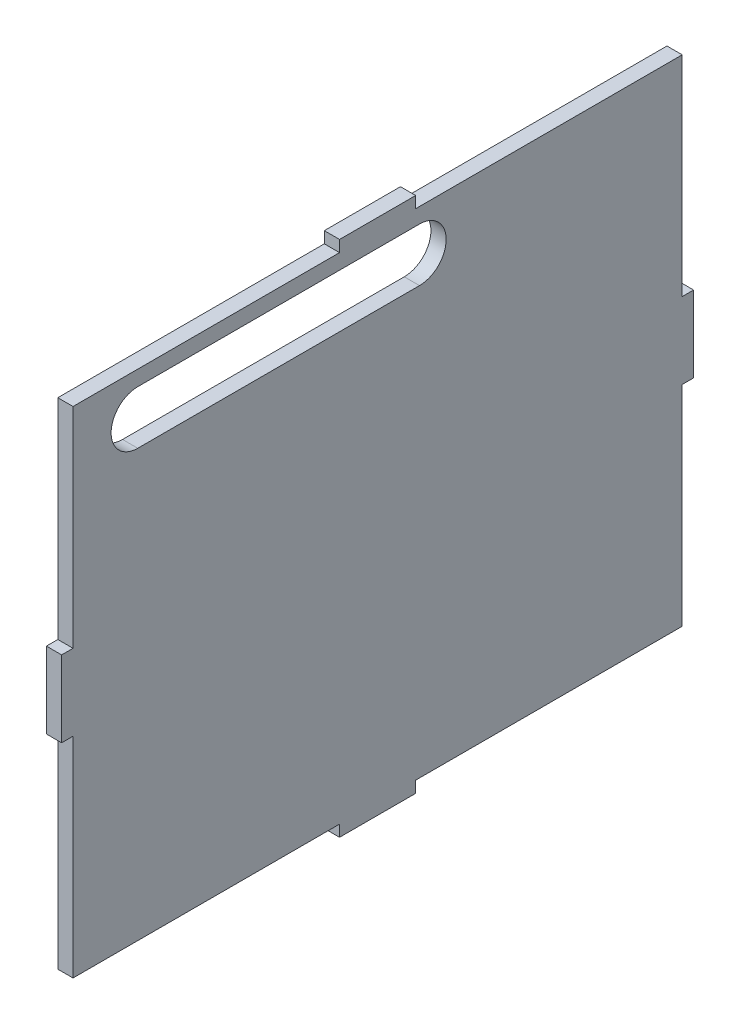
SolidWorks part; units mm, degrees
ref_plane "Plan de face" through (0, 0, 0) normal (1, 0, 0) x (0, 1, 0)
ref_plane "Plan de dessus" through (0, 0, 0) normal (0, 0, 1) x (0, 1, 0)
ref_plane "Plan de droite" through (0, 0, 0) normal (0, 1, 0) x (-1, 0, 0)
sketch "Esquisse1" plane through (0, 0, 0) normal (1, 0, 0) x (0, 0, 1)
  line L1 (0, 65) -> (80, 65)
  line L2 (0, 65) -> (0, 0)
  line L3 (0, 0) -> (80, 0)
  line L4 (80, 65) -> (80, 0)
  line L5 (-1.5, 37.5) -> (0, 37.5)
  line L6 (-1.5, 37.5) -> (-1.5, 27.5)
  line L7 (-1.5, 27.5) -> (0, 27.5)
  line L8 (0, 37.5) -> (0, 27.5)
  line L9 (35, -1.5) -> (45, -1.5)
  line L10 (35, -1.5) -> (35, 0)
  line L11 (35, 0) -> (45, 0)
  line L12 (45, -1.5) -> (45, 0)
  line L13 (80, 37.5) -> (81.5, 37.5)
  line L14 (80, 37.5) -> (80, 27.5)
  line L15 (80, 27.5) -> (81.5, 27.5)
  line L16 (81.5, 37.5) -> (81.5, 27.5)
  line L17 (35, 66.5) -> (45, 66.5)
  line L18 (35, 66.5) -> (35, 65)
  line L19 (35, 65) -> (45, 65)
  line L20 (45, 66.5) -> (45, 65)
  line L21 (34.5, 9) -> (71.5, 9)
  line L22 (34.5, 9) -> (34.5, 2)
  line L23 (34.5, 2) -> (71.5, 2)
  line L24 (71.5, 9) -> (71.5, 2)
  circle A0 centre (34.5, 5.5) radius 3.5
  circle A1 centre (71.5, 5.5) radius 3.5
  dimension "D1" = 7
  dimension "D2" = 2
extrude "Boss.-Extru.1" add sketch "Esquisse1" along normal blind 2 contours L4 L1 L2 L3 A1 L23 A0 L21 | L16 L13 L4 L15 | L20 L17 L18 L1 | L6 L7 L2 L5 | L9 L12 L3 L10
